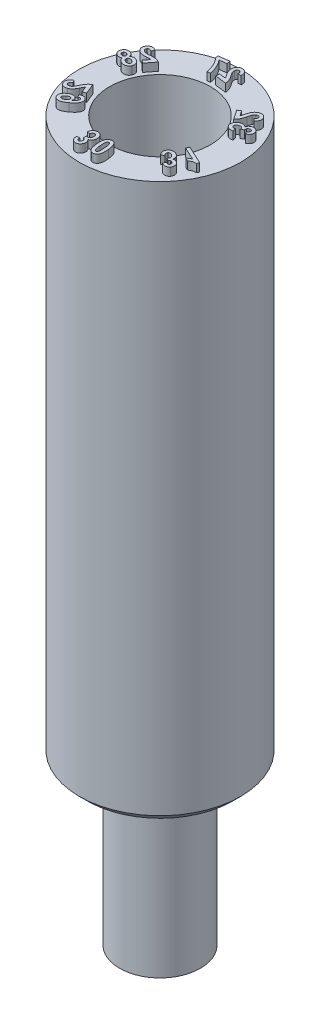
SolidWorks part; units mm, degrees
other "<M2L6-SetScrew>-<Chamfer1>" parameters "D10"=0.19
ref_plane "Front Plane" through (0, 0, 0) normal (0, 0, 1) x (1, 0, 0)
ref_plane "Top Plane" through (0, 0, 0) normal (0, 1, 0) x (1, 0, 0)
ref_plane "Right Plane" through (0, 0, 0) normal (1, 0, 0) x (0, 0, -1)
sketch "Sketch1" plane through (0, 0, 0) normal (0, 0, 1) x (1, 0, 0)
  line L0 (0, 0) -> (0, 20) construction
  line L1 (0, -2.2) -> (0, 2.2) construction
  line L2 (1, -13.8) -> (1.81, -13.8)
  line L4 (2, -13.61) -> (2, 0)
  line L5 (2, 0) -> (1.25, 0)
  line L6 (1.25, 0) -> (1.25, -2.3)
  line L7 (1.25, -2.3) -> (0.7, -2.3)
  line L8 (0.7, -2.3) -> (0.7, -10.3)
  line L9 (0.7, -10.3) -> (1, -10.3)
  line L10 (1, -10.3) -> (1, -13.8)
  line L11 (1.81, -13.8) -> (2, -13.61)
  point P6 (2, -13.8)
  dimension "D1" = 2.3
  dimension "D2" = 3.5
  dimension "D3" = 1.4
  dimension "D4" = 2.5
  dimension "D5" = 4
  dimension "D6" = 2
  dimension "D7" = 13.8
revolve "Revolve1" add sketch "Sketch1" angle 360 about L0
sketch "Sketch2" plane through (0, 0, 0) normal (0, 1, 0) x (1, 0, 0)
  line L0 (0, 0) -> (0, 2.1482) construction
  line L1 (0, 0) -> (1.8604, 1.0741) construction
  line L2 (0, 0) -> (1.8604, -1.0741) construction
  line L3 (0, 0) -> (0, -2.1482) construction
  line L4 (0, 0) -> (-1.8604, -1.0741) construction
  line L5 (0, 0) -> (-1.8604, 1.0741) construction
  arc A0 (0.3224, 1.3109) -> (0.7486, 1.1234) centre (0, 0) ccw construction
  text T0 "27    28    29    30    31    32" font "Arial Narrow" height 0.5
  point P13 (0, 0)
  point P17 (0, 0)
  point P18 (0, 0)
  point P21 (0, 0)
  dimension "D1" = 2.7
  dimension "D2" = 6
extrude "Boss-Extrude1" add sketch "Sketch2" along normal blind 0.2
inserted part "M2L6-SetScrew"
move or copy body "Body-Move/Copy2" placed by mates yes
other "Distance1" parameters "D1"=4
